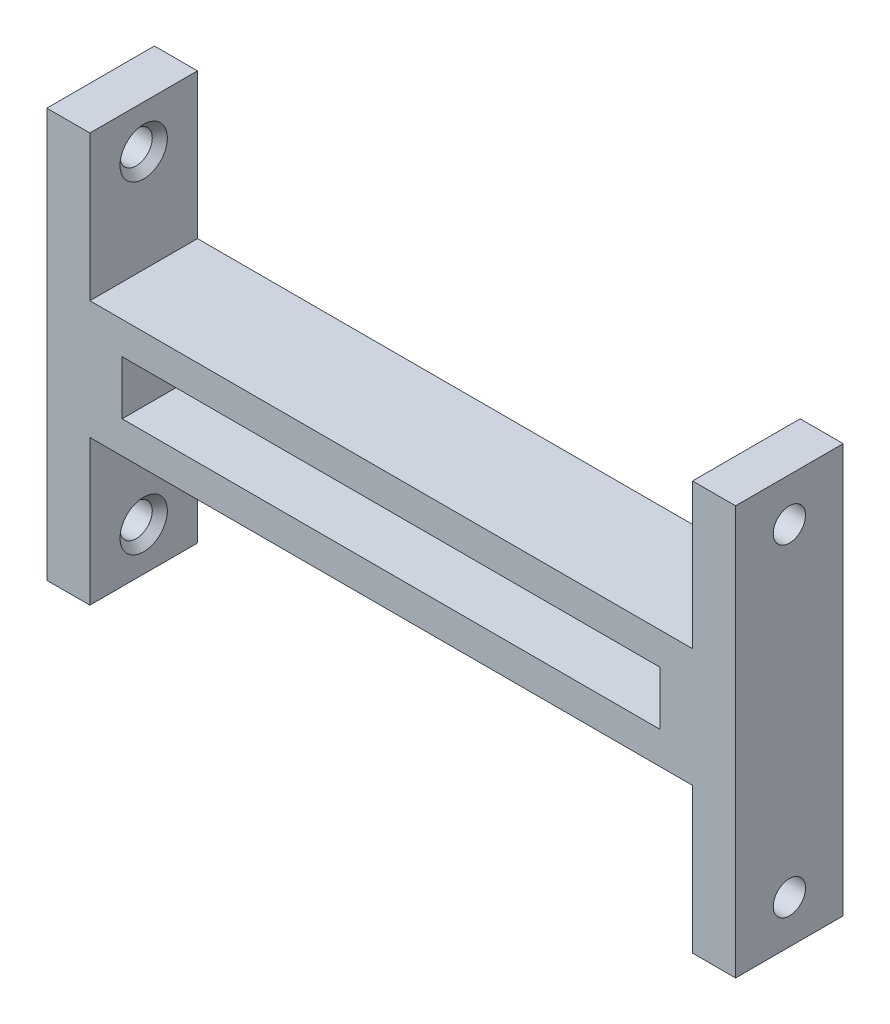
SolidWorks part; units mm, degrees
ref_plane "Front Plane" through (0, 0, 0) normal (0, 0, 1) x (1, 0, 0)
ref_plane "Top Plane" through (0, 0, 0) normal (0, 1, 0) x (1, 0, 0)
ref_plane "Right Plane" through (0, 0, 0) normal (1, 0, 0) x (0, 0, -1)
sketch "Sketch1" plane through (0, 0, 0) normal (0, 0, 1) x (1, 0, 0)
  line L0 (23.1698, 29.2957) -> (23.1698, 44.8825) construction
  line L4 (-40.8302, 34.7957) -> (39.5817, 34.7957) construction
  line L7 (-4.8302, 40.2957) -> (51.1698, 40.2957)
  line L26 (-4.8302, 29.2957) -> (51.1698, 29.2957)
  line L38 (-1.8302, 37.2957) -> (48.1698, 37.2957)
  line L39 (48.1698, 37.2957) -> (48.1698, 32.2957)
  line L40 (-1.8302, 32.2957) -> (48.1698, 32.2957)
  line L41 (-1.8302, 32.2957) -> (-1.8302, 37.2957)
  line L42 (-4.8302, 40.2957) -> (-4.8302, 53.7957)
  line L43 (-4.8302, 53.7957) -> (-8.8302, 53.7957)
  line L44 (-8.8302, 53.7957) -> (-8.8302, 15.7957)
  line L45 (-8.8302, 15.7957) -> (-4.8302, 15.7957)
  line L46 (-4.8302, 15.7957) -> (-4.8302, 29.2957)
  line L47 (51.1698, 15.7957) -> (51.1698, 29.2957)
  line L48 (-4.8302, 29.2957) -> (-4.8302, 40.2957) construction
  line L49 (55.1698, 15.7957) -> (51.1698, 15.7957)
  line L50 (51.1698, 40.2957) -> (51.1698, 53.7957)
  line L51 (55.1698, 53.7957) -> (55.1698, 15.7957)
  line L52 (51.1698, 53.7957) -> (55.1698, 53.7957)
  line L53 (51.1698, 40.2957) -> (51.1698, 29.2957) construction
  dimension "D3" = 38
  dimension "D1" = 3
  dimension "D2" = 56
  dimension "D4" = 4
  dimension "D6" = 11
extrude "Boss-Extrude1" add sketch "Sketch1" along normal blind 10
sketch "Sketch3" plane through (0, 0, 10) normal (0, 0, 1) x (1, 0, 0)
ref_plane "Plane1" through (0, 34.0457, 0) normal (0, 1, 0) x (1, 0, 0)
sketch "Sketch4" plane through (-8.8302, 0, 0) normal (-1, 0, 0) x (0, 0, 1)
  line L2 (10, 53.7957) -> (0, 53.7957) construction
  line L3 (0, 34.7957) -> (11.0862, 34.7957) construction
  line L4 (0, 53.7957) -> (0, 15.7957) construction
  circle A0 centre (5, 49.7957) radius 0.5
  circle A1 centre (5, 19.7957) radius 0.5
  dimension "D1" = 1
  dimension "D2" = 4
extrude "Cut-Extrude1" cut sketch "Sketch4" against normal through all
ref_plane "Plane2" through (23.1698, 0, 0) normal (1, 0, 0) x (0, 0, -1)
sketch "Sketch11" plane through (-8.8302, 0, 0) normal (-1, 0, 0) x (0, 0, 1)
  line L0 (0, 34.0457) -> (11.4552, 34.0457) construction
  line L1 (5.5, 34.0457) -> (-5.5, 34.0457) construction
  circle A0 centre (5, 49.7957) radius 1.5
  circle A1 centre (5, 19.7957) radius 1.5
  dimension "D1" = 3
extrude "Cut-Extrude2" cut sketch "Sketch11" against normal through all
hole_wizard "CSK for M2 Countersunk Flat Head Screw1" positions "Sketch16" profile "Sketch14" countersink size "M2" standard "ISO"
sketch "Sketch16" plane through (51.1698, 0, 0) normal (-1, 0, 0) x (0, 0, 1)
  point P0 (5, 49.7957)
  point P3 (5, 19.7957)
sketch "Sketch14" plane through (51.1698, 49.7957, 5) normal (0, 1, 0) x (0, 0, 1)
  line L0 (0, 0) -> (0, 4)
  line L1 (0, 4) -> (1.2, 4)
  line L2 (1.2, 4) -> (1.2, 1)
  line L3 (1.2, 1) -> (2.2, 0)
  line L5 (2.2, 0) -> (0, 0)
  line L6 (-1.2, 1) -> (-2.2, 0) construction
  line L11 (0, -6.35) -> (0, 107.95) construction
  dimension "Thru Hole Dia." = 2.4
  dimension "Thru Hole Depth" = 4
  dimension "Near C'Sink Dia." = 4.4
  dimension "Near C'Sink Angle" = 90
mirror "Mirror2" about plane through (23.1698, 0, 0) normal (1, 0, 0) of "CSK for M2 Countersunk Flat Head Screw1"
